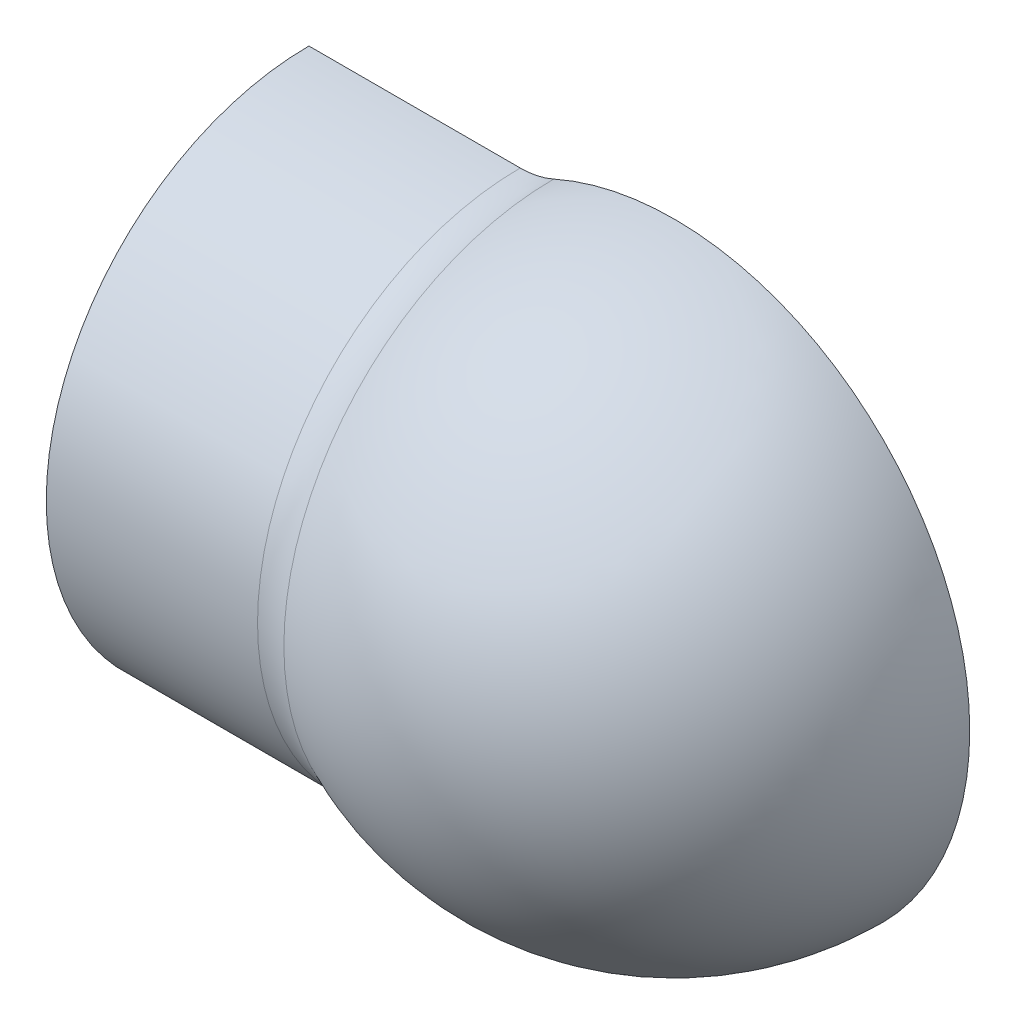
SolidWorks part; units mm, degrees
ref_plane "Plan de face" through (0, 0, 0) normal (0, 0, 1) x (1, 0, 0)
ref_plane "Plan de dessus" through (0, 0, 0) normal (0, 1, 0) x (1, 0, 0)
ref_plane "Plan de droite" through (0, 0, 0) normal (1, 0, 0) x (0, 0, -1)
sketch "Esquisse1" plane through (0, 0, 0) normal (0, 0, 1) x (1, 0, 0)
  line L0 (-44.5, 0) -> (86.5229, 0) construction
  line L1 (-44.5, 0) -> (-44.5, 32)
  line L2 (-44.5, 32) -> (-16.4924, 32)
  line L3 (-44.5, 0) -> (36, 0)
  arc A0 (36, 0) -> (-16.4924, 32) centre (0, 0) ccw
  dimension "D1" = 72
  dimension "D2" = 44.5
  dimension "D3" = 64
revolve "Révolution1" add sketch "Esquisse1" angle 180 about L0
fillet "Congé1" radius 10 1 edges at (-16.4924, 0, 32)
shell "Coque2" thickness 3
